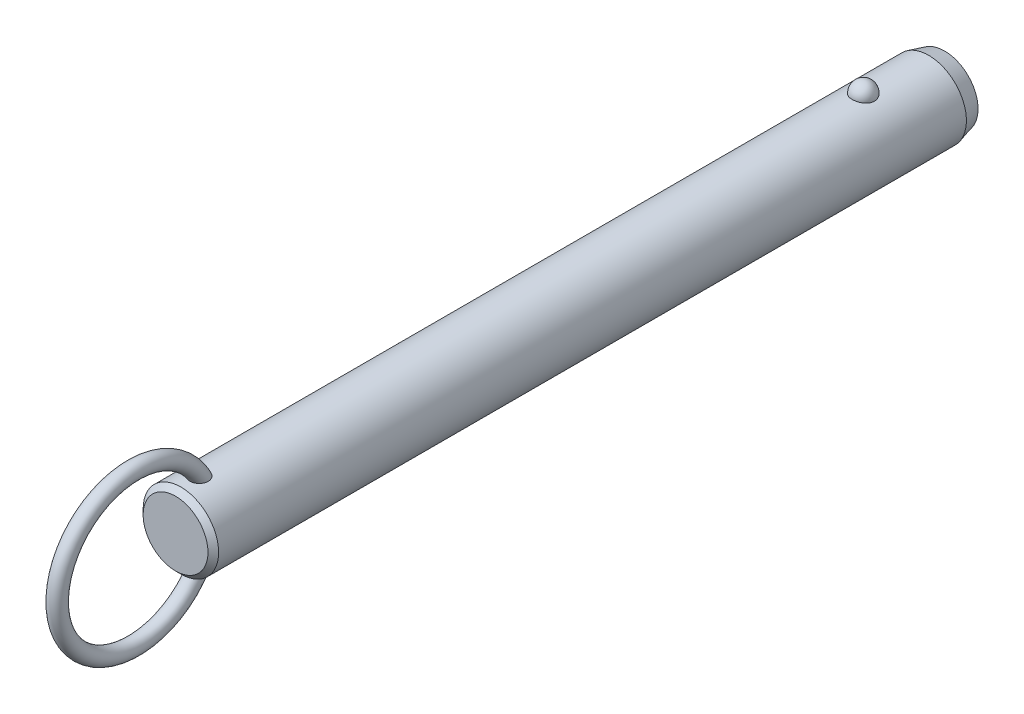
SolidWorks part; units mm, degrees
ref_plane "Front Plane" through (0, 0, 0) normal (0, 0, 1) x (1, 0, 0)
ref_plane "Top Plane" through (0, 0, 0) normal (0, 1, 0) x (1, 0, 0)
ref_plane "Right Plane" through (0, 0, 0) normal (1, 0, 0) x (0, 0, -1)
sketch "Sketch2" plane through (0, 0, 0) normal (0, 0, 1) x (1, 0, 0)
  circle A0 centre (0, 0) radius 7.1
  point P3 (0, 7.1)
  dimension "D1" = 14.2
extrude "Boss-Extrude1" add sketch "Sketch2" along normal blind 119.4
sketch "Sketch3" plane through (0, 0, 0) normal (0, 0, -1) x (-1, 0, 0)
  circle A0 centre (0, 0) radius 7.1
  dimension "D1" = 14.2
extrude "Boss-Extrude2" add sketch "Sketch3" along normal blind 17.4
chamfer "Chamfer1" distance 3 angle 15 1 edges at (-7.1, 0, -17.4)
sketch "Sketch12" plane through (0, 0, 0) normal (1, 0, 0) x (0, 0, -1)
  line L0 (-119.4, 7.1) -> (-119.4, -7.1) construction
  point P0 (-119.4, 0)
sketch "Sketch13" plane through (0, 0, 0) normal (1, 0, 0) x (0, 0, -1)
  circle A0 centre (-135.25, 0) radius 15.85
  point P2 (-119.4, 0)
  dimension "D1" = 31.7
sketch "Sketch14" plane through (0, 0, 0) normal (0, 1, 0) x (1, 0, 0)
  circle A0 centre (0, -120.9) radius 1.5
  point P2 (0, -119.4)
  dimension "D1" = 3
sweep "Sweep1" add profiles "Sketch14" path "Sketch13"
sketch "Sketch15" plane through (0, 0, 119.4) normal (0, 0, 1) x (1, 0, 0)
  circle A0 centre (0, 0) radius 7.1
  dimension "D1" = 14.2
extrude "Boss-Extrude3" add sketch "Sketch15" along normal blind 7.92
chamfer "Chamfer2" distance 1 angle 45 1 edges at (7.1, 0, 127.32)
sketch "Sketch18" plane through (0, 0, 0) normal (1, 0, 0) x (0, 0, -1)
  line L0 (14.4, 7.1) -> (-121.0792, 7.1) construction
  line L1 (2.1, 9.2) -> (2.1, 5)
  line L2 (-121.0792, -7.1) -> (14.4, -7.1) construction
  arc A0 (2.1, 9.2) -> (2.1, 5) centre (2.1, 7.1) ccw
  point P4 (0, 7.1)
  dimension "D1" = 16.3
revolve "Revolve1" add sketch "Sketch18" angle 360 about L1
